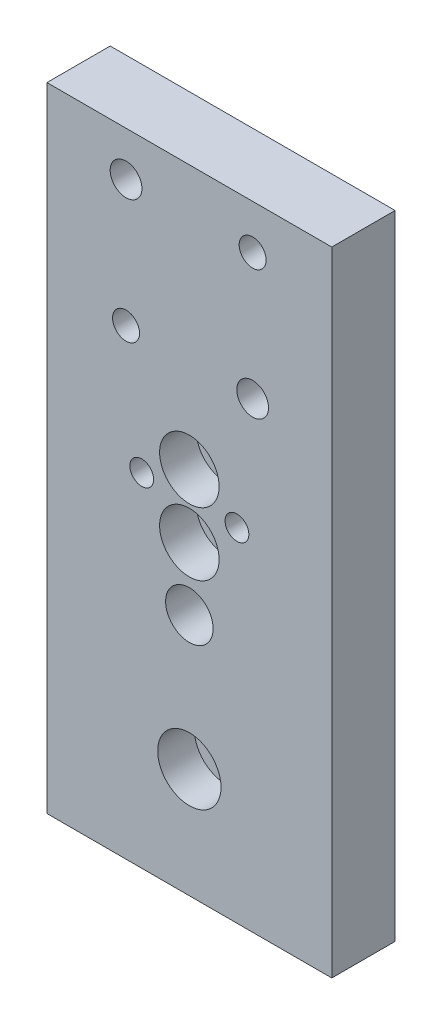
SolidWorks part; units mm, degrees
ref_plane "Front Plane" through (0, 0, 0) normal (0, 0, 1) x (1, 0, 0)
ref_plane "Top Plane" through (0, 0, 0) normal (0, 1, 0) x (1, 0, 0)
ref_plane "Right Plane" through (0, 0, 0) normal (1, 0, 0) x (0, 0, -1)
sketch "Sketch1" plane through (0, 0, 0) normal (0, 0, 1) x (1, 0, 0)
  line L1 (-14.2875, 31.75) -> (14.2875, 31.75)
  line L2 (-14.2875, 31.75) -> (-14.2875, -31.75)
  line L3 (-14.2875, -31.75) -> (14.2875, -31.75)
  line L4 (14.2875, 31.75) -> (14.2875, -31.75)
  dimension "D1" = 31.75
  dimension "D2" = 28.575
  dimension "D3" = 14.2875
  dimension "D4" = 28.575
  dimension "D6" = 63.5
extrude "Extrude1" add sketch "Sketch1" against normal blind 6.35
sketch "Sketch2" plane through (0, 0, 0) normal (0, 0, 1) x (1, 0, 0)
  line L0 (-14.2875, -31.75) -> (14.2875, -31.75) construction
  line L1 (0, 40.2803) -> (0, -17.8929) construction
  circle A0 centre (-6.35, 27.305) radius 1.5938
  circle A1 centre (6.35, 14.605) radius 1.5939
  circle A2 centre (0, 5.2832) radius 1.7856
  circle A3 centre (0, -1.0668) radius 1.7856
  circle A4 centre (0, -7.366) radius 2.3813
  circle A5 centre (0, -20.7518) radius 1.8288
  point P10 (0, -31.75)
  dimension "D1" = 3.1877
  dimension "D2" = 3.1877
  dimension "D3" = 4.7625
  dimension "D4" = 3.5712
  dimension "D5" = 3.5712
  dimension "D9" = 3.6576
  dimension "D6" = 37.0332
  dimension "D7" = 30.6832
  dimension "D8" = 24.384
  dimension "D10" = 10.9982
  dimension "D11" = 6.35
  dimension "D12" = 6.35
  dimension "D13" = 59.055
  dimension "D14" = 46.355
extrude "Cut-Extrude1" cut sketch "Sketch2" against normal through all
sketch "Sketch3" plane through (0, 0, 0) normal (0, 0, 1) x (1, 0, 0)
  circle A0 centre (0, -20.7518) radius 3.175
  circle A1 centre (0, -1.0668) radius 2.9845
  circle A2 centre (0, 5.2832) radius 2.9845
  dimension "D1" = 5.969
  dimension "D2" = 5.969
  dimension "D3" = 6.35
extrude "Cut-Extrude2" cut sketch "Sketch3" against normal blind 3.683 contours A1
sketch "Sketch4" plane through (0, 0, -6.35) normal (0, 0, -1) x (-1, 0, 0)
  line L0 (14.2875, -31.75) -> (-14.2875, -31.75) construction
  circle A0 centre (-4.7752, 2.6162) radius 1.1938
  circle A1 centre (4.7752, 2.6162) radius 1.1938
  dimension "D1" = 2.3876
  dimension "D2" = 2.3876
  dimension "D3" = 34.3662
  dimension "D4" = 34.3662
  dimension "D5" = 4.7752
  dimension "D6" = 4.7752
extrude "Cut-Extrude3" cut sketch "Sketch4" against normal through all
sketch "Sketch5" plane through (0, 0, -6.35) normal (0, 0, -1) x (-1, 0, 0)
  circle A0 centre (0, -20.7518) radius 3.302
  dimension "D1" = 6.604
  dimension "D2" = 20.7518
extrude "Cut-Extrude4" cut sketch "Sketch5" against normal blind 1.27
hole_wizard "#6-32 Tapped Hole1" positions "Sketch7" profile "Sketch6" tap size "#6-32" standard "Ansi Inch"
sketch "Sketch7" plane through (0, 0, -6.35) normal (0, 0, -1) x (-1, 0, 0)
  line L0 (14.2875, -31.75) -> (-14.2875, -31.75) construction
  line L1 (0, 27.223) -> (0, -28.8308) construction
  point P0 (-6.35, 27.305)
  point P1 (6.35, 14.605)
  dimension "D1" = 59.055
  dimension "D2" = 46.355
  dimension "D3" = 6.35
  dimension "D4" = 6.35
sketch "Sketch6" plane through (6.35, 27.305, -6.35) normal (1, 0, 0) x (0, 1, 0)
  line L0 (0, 0) -> (0, 6.35)
  line L1 (0, 6.35) -> (1.3525, 6.35)
  line L2 (1.3525, 6.35) -> (1.3525, 0)
  line L5 (1.3525, 0) -> (0, 0)
  line L11 (0, -6.35) -> (0, 107.95) construction
  dimension "Thru Tap Drill Dia." = 2.7051
  dimension "Thru Tap Drill Depth" = 6.35
